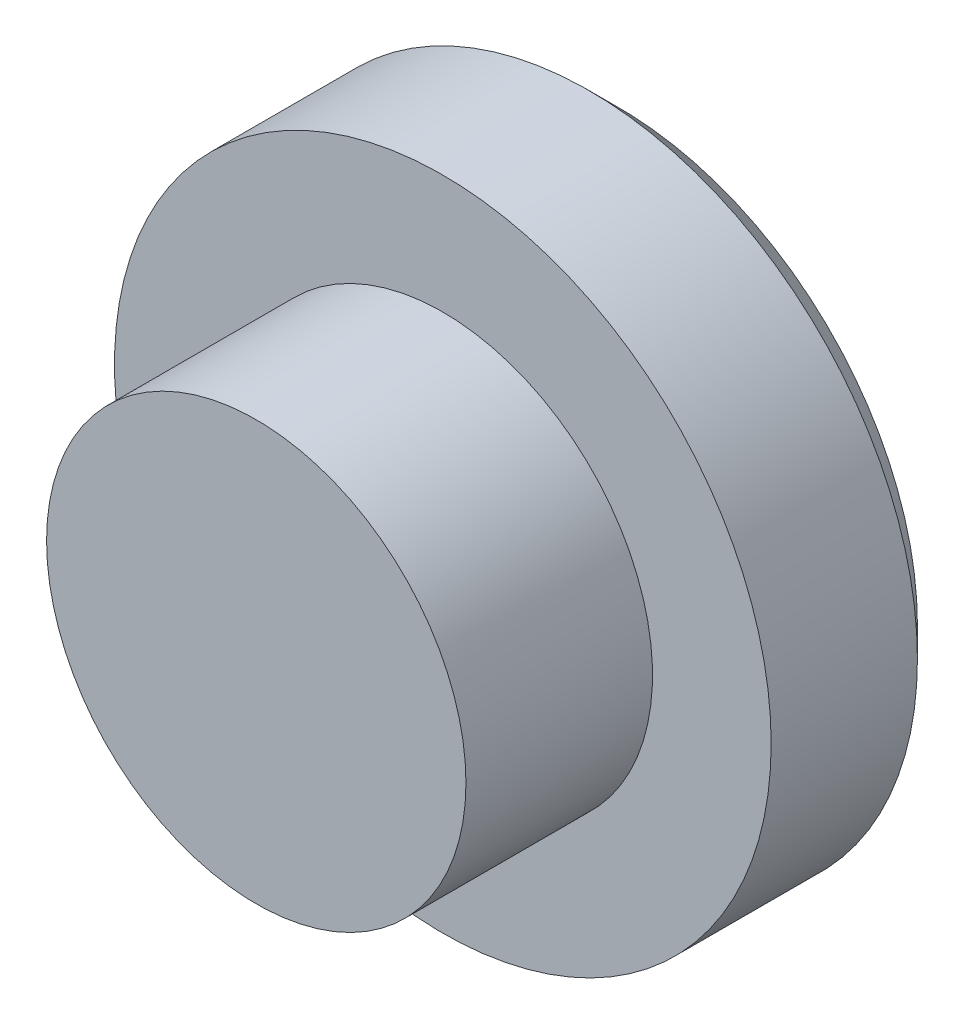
SolidWorks part; units mm, degrees
ref_plane "Front Plane" through (0, 0, 0) normal (0, 0, 1) x (1, 0, 0)
ref_plane "Top Plane" through (0, 0, 0) normal (0, 1, 0) x (1, 0, 0)
ref_plane "Right Plane" through (0, 0, 0) normal (1, 0, 0) x (0, 0, -1)
sketch "Sketch1" plane through (0, 0, 0) normal (0, 0, 1) x (1, 0, 0)
  circle A0 centre (0, 0) radius 3.5687
  dimension "D1" = 7.1374
extrude "Boss-Extrude1" add sketch "Sketch1" along normal blind 3.175
sketch "Sketch2" plane through (0, 0, 0) normal (0, 0, -1) x (-1, 0, 0)
  circle A0 centre (0, 0) radius 5.588
  dimension "D1" = 11.176
extrude "Boss-Extrude2" add sketch "Sketch2" along normal blind 2.9972
chamfer "Chamfer1" distance 0.508 angle 45 1 edges at (-5.588, 0, -2.9972)
